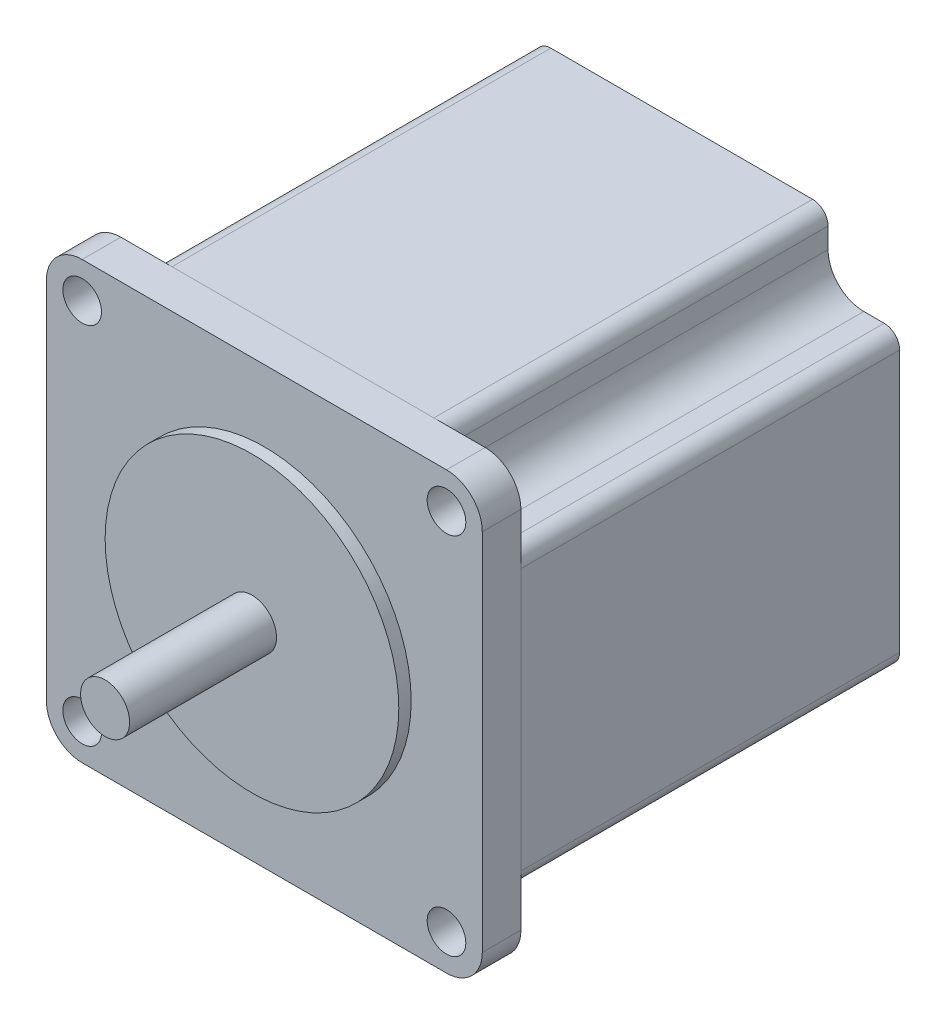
SolidWorks part; units mm, degrees
ref_plane "Ön Düzlem" through (0, 0, 0) normal (0, 0, 1) x (1, 0, 0)
ref_plane "Üst Düzlem" through (0, 0, 0) normal (0, 1, 0) x (1, 0, 0)
ref_plane "Sağ Düzlem" through (0, 0, 0) normal (1, 0, 0) x (0, 0, -1)
sketch "Sketch1" plane through (0, 0, 0) normal (0, 0, 1) x (1, 0, 0)
  line L0 (-23.57, 23.57) -> (23.57, 23.57) construction
  line L1 (23.57, 28.2) -> (-23.57, 28.2)
  line L2 (28.2, 23.57) -> (28.2, -23.57)
  line L3 (23.57, -28.2) -> (-23.57, -28.2)
  line L4 (-28.2, 23.57) -> (-28.2, -23.57)
  line L5 (28.2, 28.2) -> (-28.2, -28.2) construction
  line L6 (28.2, -28.2) -> (-28.2, 28.2) construction
  line L7 (23.57, 23.57) -> (23.57, -23.57) construction
  line L8 (23.57, -23.57) -> (-23.57, -23.57) construction
  line L9 (-23.57, -23.57) -> (-23.57, 23.57) construction
  line L10 (28.2, 23.57) -> (28.2, 28.2) construction
  line L11 (28.2, 28.2) -> (23.57, 28.2) construction
  line L12 (28.2, -23.57) -> (28.2, -28.2) construction
  line L13 (28.2, -28.2) -> (23.57, -28.2) construction
  line L14 (-23.57, -28.2) -> (-28.2, -28.2) construction
  line L15 (-28.2, -28.2) -> (-28.2, -23.57) construction
  line L16 (-28.2, 23.57) -> (-28.2, 28.2) construction
  line L17 (-28.2, 28.2) -> (-23.57, 28.2) construction
  circle A0 centre (-23.57, -23.57) radius 2.5
  circle A1 centre (-23.57, 23.57) radius 2.5
  circle A2 centre (23.57, 23.57) radius 2.5
  circle A3 centre (23.57, -23.57) radius 2.5
  arc A4 (28.2, 23.57) -> (23.57, 28.2) centre (23.57, 23.57) ccw
  arc A5 (-23.57, 28.2) -> (-28.2, 23.57) centre (-23.57, 23.57) ccw
  arc A6 (-28.2, -23.57) -> (-23.57, -28.2) centre (-23.57, -23.57) ccw
  arc A7 (23.57, -28.2) -> (28.2, -23.57) centre (23.57, -23.57) ccw
  point P0 (0, 0)
  dimension "D3" = 5
  dimension "D1" = 56.4
  dimension "D2" = 47.14
extrude "Boss-Extrude1" add sketch "Sketch1" against normal blind 5
sketch "Sketch2" plane through (0, 0, 0) normal (0, 0, 1) x (1, 0, 0)
  circle A0 centre (0, 0) radius 19
  dimension "D1" = 38
extrude "Boss-Extrude2" add sketch "Sketch2" along normal blind 1.6
sketch "Sketch3" plane through (0, 0, 1.6) normal (0, 0, 1) x (1, 0, 0)
  circle A0 centre (0, 0) radius 3.175
  dimension "D1" = 6.35
extrude "Boss-Extrude3" add sketch "Sketch3" along normal blind 19
sketch "Sketch5" plane through (0, 0, -5) normal (0, 0, -1) x (-1, 0, 0)
  line L0 (-28.2, 28.2) -> (28.2, -28.2) construction
  line L1 (17.5, -20) -> (-17.5, -20) construction
  line L2 (20, -17.5) -> (20, 17.5) construction
  line L3 (17.5, 20) -> (-17.5, 20) construction
  line L4 (-20, -17.5) -> (-20, 17.5) construction
  line L5 (20, -20) -> (-20, 20) construction
  line L6 (20, 20) -> (-20, -20) construction
  line L7 (-18.94, -23.57) -> (-18.94, -26.2)
  line L8 (23.57, -28.2) -> (-23.57, -28.2) construction
  line L9 (-20, 17.5) -> (-20, 20) construction
  line L10 (-20, 20) -> (-17.5, 20) construction
  line L11 (17.5, 20) -> (20, 20) construction
  line L12 (20, 20) -> (20, 17.5) construction
  line L13 (17.5, -20) -> (20, -20) construction
  line L14 (20, -20) -> (20, -17.5) construction
  line L15 (-20, -17.5) -> (-20, -20) construction
  line L16 (-20, -20) -> (-17.5, -20) construction
  line L17 (18.94, -23.57) -> (18.94, -26.2)
  line L18 (16.94, -28.2) -> (-16.94, -28.2)
  line L19 (23.57, -18.94) -> (26.2, -18.94)
  line L20 (28.2, 23.57) -> (28.2, -23.57) construction
  line L21 (28.2, -16.94) -> (28.2, 16.94)
  line L22 (26.2, 18.94) -> (23.57, 18.94)
  line L23 (-18.94, 23.57) -> (-18.94, 26.2)
  line L24 (-16.94, 28.2) -> (16.94, 28.2)
  line L25 (18.94, 26.2) -> (18.94, 23.57)
  line L26 (-23.57, 18.94) -> (-26.2, 18.94)
  line L27 (-28.2, 16.94) -> (-28.2, -16.94)
  line L28 (-26.2, -18.94) -> (-23.57, -18.94)
  line L29 (23.57, -18.94) -> (-23.57, -18.94) construction
  line L30 (-18.94, -23.57) -> (-18.94, 23.57) construction
  line L31 (-23.57, 18.94) -> (23.57, 18.94) construction
  line L32 (18.94, 23.57) -> (18.94, -23.57) construction
  arc A0 (17.5, -20) -> (20, -17.5) centre (17.5, -17.5) ccw construction
  arc A1 (-17.5, 20) -> (-20, 17.5) centre (-17.5, 17.5) ccw construction
  arc A2 (20, 17.5) -> (17.5, 20) centre (17.5, 17.5) ccw construction
  arc A3 (-20, -17.5) -> (-17.5, -20) centre (-17.5, -17.5) ccw construction
  arc A4 (-23.57, 18.94) -> (-18.94, 23.57) centre (-23.57, 23.57) ccw
  arc A5 (18.94, 23.57) -> (23.57, 18.94) centre (23.57, 23.57) ccw
  arc A6 (23.57, -18.94) -> (18.94, -23.57) centre (23.57, -23.57) ccw
  arc A7 (-18.94, -23.57) -> (-23.57, -18.94) centre (-23.57, -23.57) ccw
  arc A8 (-28.2, -16.94) -> (-26.2, -18.94) centre (-26.2, -16.94) ccw
  arc A9 (-28.2, 16.94) -> (-26.2, 18.94) centre (-26.2, 16.94) cw
  arc A10 (-16.94, 28.2) -> (-18.94, 26.2) centre (-16.94, 26.2) ccw
  arc A11 (18.94, 26.2) -> (16.94, 28.2) centre (16.94, 26.2) ccw
  arc A12 (28.2, 16.94) -> (26.2, 18.94) centre (26.2, 16.94) ccw
  arc A13 (28.2, -16.94) -> (26.2, -18.94) centre (26.2, -16.94) cw
  arc A14 (16.94, -28.2) -> (18.94, -26.2) centre (16.94, -26.2) ccw
  arc A15 (-18.94, -26.2) -> (-16.94, -28.2) centre (-16.94, -26.2) ccw
  point P0 (0, 0)
  point P59 (28.2, 18.94)
  point P62 (28.2, -18.94)
  point P65 (18.94, -28.2)
  point P68 (-18.94, -28.2)
  dimension "D3" = 2
  dimension "D1" = 2.5
  dimension "D2" = 40
extrude "Boss-Extrude4" add sketch "Sketch5" along normal blind 49 separate body
sketch "Sketch6" plane through (0, 0, 20.6) normal (0, 0, 1) x (1, 0, 0)
  point P0 (0, 0)
  point P1 (0, 0)
